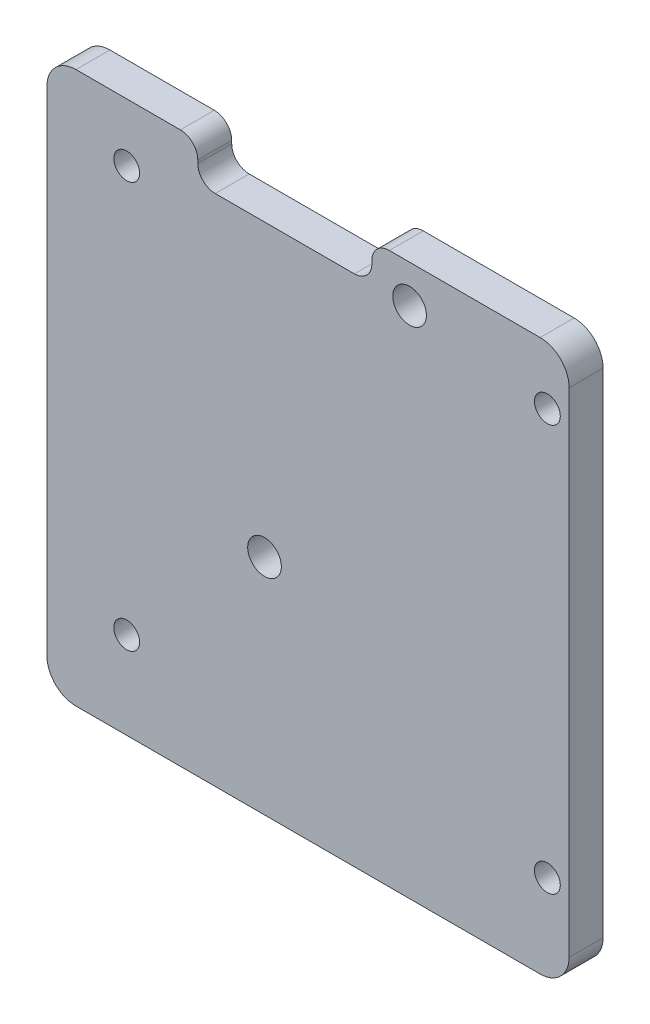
SolidWorks part; units mm, degrees
ref_plane "Front Plane" through (0, 0, 0) normal (0, 0, 1) x (1, 0, 0)
ref_plane "Top Plane" through (0, 0, 0) normal (0, 1, 0) x (1, 0, 0)
ref_plane "Right Plane" through (0, 0, 0) normal (1, 0, 0) x (0, 0, -1)
sketch "Sketch1" plane through (0, 0, 0) normal (0, 0, 1) x (1, 0, 0)
  line L1 (-22.86, 24.13) -> (22.86, 24.13)
  line L2 (-22.86, 24.13) -> (-22.86, -24.13)
  line L3 (-22.86, -24.13) -> (22.86, -24.13)
  line L4 (22.86, 24.13) -> (22.86, -24.13)
  line L5 (-22.86, 24.13) -> (22.86, -24.13) construction
  line L6 (-22.86, -24.13) -> (22.86, 24.13) construction
  point P0 (0, 0)
  dimension "D1" = 45.72
  dimension "D2" = 48.26
extrude "Boss-Extrude1" add sketch "Sketch1" along normal blind 2.9718
hole_wizard "#4 Clearance Hole1" positions "Sketch3" profile "Sketch4" hole size "#4" standard "ANSI Inch"
sketch "Sketch3" plane through (0, 0, 2.9718) normal (0, 0, 1) x (1, 0, 0)
  line L0 (2.54, 24.13) -> (2.54, -24.13) construction
  line L1 (22.86, 24.13) -> (-22.86, 24.13) construction
  line L2 (-22.86, -24.13) -> (22.86, -24.13) construction
  line L4 (22.86, -24.13) -> (22.86, 24.13) construction
  point P11 (8.89, 20.828)
  point P13 (-3.81, -4.572)
  dimension "D1" = 20.32
  dimension "D2" = 6.35
  dimension "D3" = 3.302
  dimension "D4" = 28.702
  dimension "D5" = 6.35
sketch "Sketch4" plane through (-3.81, -4.572, 2.9718) normal (1, 0, 0) x (0, -1, 0)
  line L0 (0, 0) -> (0, 2.9718)
  line L1 (0, 2.9718) -> (1.4732, 2.9718)
  line L2 (1.4732, 2.9718) -> (1.4732, 0)
  line L5 (1.4732, 0) -> (0, 0)
  line L11 (0, -6.35) -> (0, 107.95) construction
  dimension "Thru Hole Dia." = 2.9464
  dimension "Thru Hole Depth" = 2.9718
sketch "Sketch6" plane through (0, 0, 2.9718) normal (0, 0, 1) x (1, 0, 0)
  line L0 (2.54, 24.13) -> (2.54, -24.13) construction
  line L1 (22.86, 24.13) -> (-22.86, 24.13) construction
  line L2 (-22.86, -24.13) -> (22.86, -24.13) construction
  line L3 (22.86, -24.13) -> (22.86, 24.13) construction
  line L5 (5.588, 27.432) -> (-9.652, 27.432)
  line L6 (5.588, 27.432) -> (5.588, 20.828)
  line L7 (5.588, 20.828) -> (-9.652, 20.828)
  line L8 (-9.652, 27.432) -> (-9.652, 20.828)
  line L9 (5.588, 27.432) -> (-9.652, 20.828) construction
  line L10 (5.588, 20.828) -> (-9.652, 27.432) construction
  point P8 (-2.032, 24.13)
  dimension "D1" = 20.32
  dimension "D2" = 4.572
  dimension "D3" = 6.604
  dimension "D4" = 15.24
extrude "Cut-Extrude1" cut sketch "Sketch6" against normal through all
fillet "Fillet1" radius 1.524 4 edges at (5.588, 24.13, 1.4859) (-9.652, 24.13, 1.4859) (-9.652, 20.828, 1.4859) (5.588, 20.828, 1.4859)
hole_wizard "#2 Clearance Hole1" positions "Sketch7" profile "Sketch8" hole size "#2" standard "ANSI Inch"
sketch "Sketch7" plane through (0, 0, 2.9718) normal (0, 0, 1) x (1, 0, 0)
  line L0 (20.955, 24.13) -> (20.955, -24.13) construction
  line L1 (22.86, 24.13) -> (7.112, 24.13) construction
  line L2 (-22.86, -24.13) -> (22.86, -24.13) construction
  line L4 (-15.875, 24.13) -> (-15.875, -24.13) construction
  line L5 (-11.176, 24.13) -> (-22.86, 24.13) construction
  line L7 (-22.86, 19.05) -> (22.86, 19.05) construction
  line L8 (-22.86, 24.13) -> (-22.86, -24.13) construction
  line L9 (22.86, -24.13) -> (22.86, 24.13) construction
  line L11 (-22.86, -16.51) -> (22.86, -16.51) construction
  point P26 (-15.875, 19.05)
  point P28 (20.955, 19.05)
  point P30 (-15.875, -16.51)
  point P32 (20.955, -16.51)
  dimension "D1" = 1.905
  dimension "D2" = 5.08
  dimension "D3" = 6.985
  dimension "D4" = 7.62
sketch "Sketch8" plane through (20.955, -16.51, 2.9718) normal (1, 0, 0) x (0, -1, 0)
  line L0 (0, 0) -> (0, 2.9718)
  line L1 (0, 2.9718) -> (1.1303, 2.9718)
  line L2 (1.1303, 2.9718) -> (1.1303, 0)
  line L5 (1.1303, 0) -> (0, 0)
  line L11 (0, -6.35) -> (0, 107.95) construction
  dimension "Thru Hole Dia." = 2.2606
  dimension "Thru Hole Depth" = 2.9718
fillet "Fillet2" radius 2.54 4 edges at (22.86, -24.13, 1.4859) (-22.86, -24.13, 1.4859) (-22.86, 24.13, 1.4859) (22.86, 24.13, 1.4859)
sketch "Sketch11" plane through (0, 0, 2.9718) normal (0, 0, 1) x (1, 0, 0)
  line L16 (-20.32, -24.2316) -> (20.32, -24.2316)
  line L17 (22.9616, -21.59) -> (22.9616, 21.59)
  line L18 (20.32, 24.2316) -> (7.112, 24.2316)
  line L19 (5.4864, 22.606) -> (5.4864, 22.352)
  line L20 (4.064, 20.9296) -> (-8.128, 20.9296)
  line L21 (-9.5504, 22.352) -> (-9.5504, 22.606)
  line L22 (-11.176, 24.2316) -> (-20.32, 24.2316)
  line L23 (-22.9616, 21.59) -> (-22.9616, -21.59)
  line L24 (-20.32, -24.2316) -> (20.32, -24.2316)
  line L25 (22.9616, -21.59) -> (22.9616, 21.59)
  line L26 (20.32, 24.2316) -> (7.112, 24.2316)
  line L27 (5.4864, 22.606) -> (5.4864, 22.352)
  line L28 (4.064, 20.9296) -> (-8.128, 20.9296)
  line L29 (-9.5504, 22.352) -> (-9.5504, 22.606)
  line L30 (-11.176, 24.2316) -> (-20.32, 24.2316)
  line L31 (-22.9616, 21.59) -> (-22.9616, -21.59)
  circle A10 centre (-15.875, 19.05) radius 1.0287
  circle A11 centre (-15.875, 19.05) radius 1.0287
  circle A13 centre (8.89, 20.828) radius 1.3716
  circle A14 centre (8.89, 20.828) radius 1.3716
  arc A16 (20.32, -24.2316) -> (22.9616, -21.59) centre (20.32, -21.59) ccw
  arc A17 (22.9616, 21.59) -> (20.32, 24.2316) centre (20.32, 21.59) ccw
  arc A18 (7.112, 24.2316) -> (5.4864, 22.606) centre (7.112, 22.606) ccw
  arc A19 (4.064, 20.9296) -> (5.4864, 22.352) centre (4.064, 22.352) ccw
  arc A20 (-9.5504, 22.352) -> (-8.128, 20.9296) centre (-8.128, 22.352) ccw
  arc A21 (-9.5504, 22.606) -> (-11.176, 24.2316) centre (-11.176, 22.606) ccw
  arc A22 (-20.32, 24.2316) -> (-22.9616, 21.59) centre (-20.32, 21.59) ccw
  arc A23 (-22.9616, -21.59) -> (-20.32, -24.2316) centre (-20.32, -21.59) ccw
  arc A24 (20.32, -24.2316) -> (22.9616, -21.59) centre (20.32, -21.59) ccw
  arc A25 (22.9616, 21.59) -> (20.32, 24.2316) centre (20.32, 21.59) ccw
  arc A26 (7.112, 24.2316) -> (5.4864, 22.606) centre (7.112, 22.606) ccw
  arc A27 (4.064, 20.9296) -> (5.4864, 22.352) centre (4.064, 22.352) ccw
  arc A28 (-9.5504, 22.352) -> (-8.128, 20.9296) centre (-8.128, 22.352) ccw
  arc A29 (-9.5504, 22.606) -> (-11.176, 24.2316) centre (-11.176, 22.606) ccw
  arc A30 (-20.32, 24.2316) -> (-22.9616, 21.59) centre (-20.32, 21.59) ccw
  arc A31 (-22.9616, -21.59) -> (-20.32, -24.2316) centre (-20.32, -21.59) ccw
  circle A32 centre (20.955, 19.05) radius 1.0287
  circle A33 centre (20.955, 19.05) radius 1.0287
  circle A35 centre (-3.81, -4.572) radius 1.3716
  circle A36 centre (-3.81, -4.572) radius 1.3716
  circle A38 centre (-15.875, -16.51) radius 1.0287
  circle A39 centre (-15.875, -16.51) radius 1.0287
  circle A41 centre (20.955, -16.51) radius 1.0287
  circle A42 centre (20.955, -16.51) radius 1.0287
equation "\"t\"= .117in'plywood thickness"
equation "\"kerf\"= .004in'laser cutter kerf"
equation "\"D1@Boss-Extrude1\"=\"t\""
equation "\"D2@Sketch11\"=\"kerf\""
equation "\"D3@Sketch11\"=\"kerf\""
equation "\"D4@Sketch11\"=\"kerf\""
equation "\"D5@Sketch11\"=\"kerf\""
equation "\"D6@Sketch11\"=\"kerf\""
equation "\"D7@Sketch11\"=\"kerf\""
equation "\"D1@Sketch11\"=\"kerf\""
